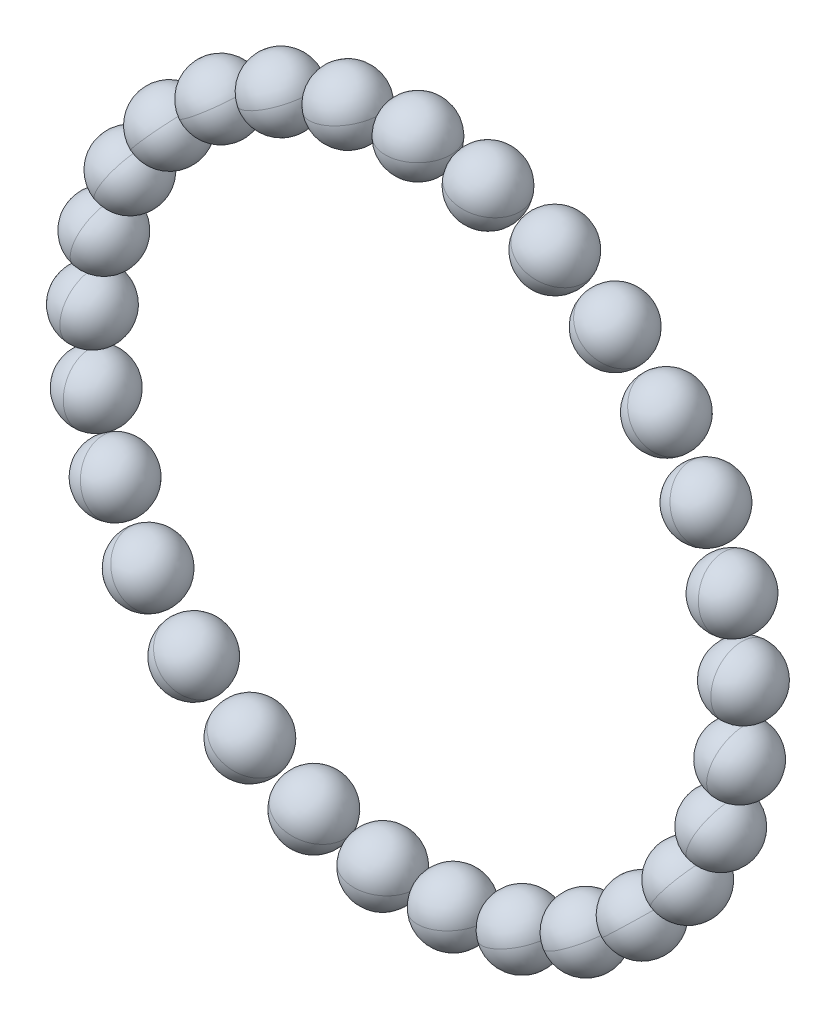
SolidWorks part; units mm, degrees
ref_plane "Přední rovina" through (0, 0, 0) normal (0, 0, 1) x (1, 0, 0)
ref_plane "Horní rovina" through (0, 0, 0) normal (0, 1, 0) x (1, 0, 0)
ref_plane "Pravá rovina" through (0, 0, 0) normal (1, 0, 0) x (0, 0, -1)
imported_body "Importovaný1"
sketch3d "3DSkica1"
  line L0 (0, 0, 0) -> (0, 0, -26.5252)
pattern_circular "Kruhové pole2" count 29 over 360 about axis through (0, 0, 0) along (0, 0, -1)
